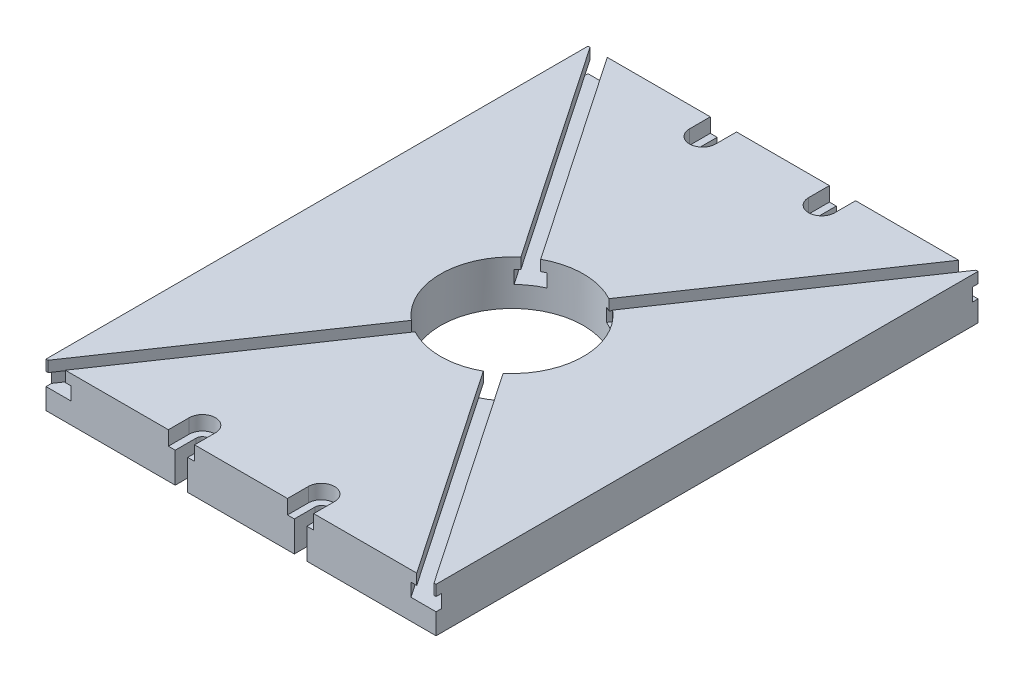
SolidWorks part; units mm, degrees
ref_plane "Plan de face" through (0, 0, 0) normal (0, 0, 1) x (1, 0, 0)
ref_plane "Plan de dessus" through (0, 0, 0) normal (0, 1, 0) x (1, 0, 0)
ref_plane "Plan de droite" through (0, 0, 0) normal (1, 0, 0) x (0, 0, -1)
sketch "Esquisse1" plane through (0, 0, 0) normal (0, 1, 0) x (1, 0, 0)
  line L1 (-327.5, 455) -> (327.5, 455)
  line L2 (-327.5, 455) -> (-327.5, -455)
  line L3 (-327.5, -455) -> (327.5, -455)
  line L4 (327.5, 455) -> (327.5, -455)
  line L5 (-327.5, 455) -> (327.5, -455) construction
  line L6 (-327.5, -455) -> (327.5, 455) construction
  point P0 (0, 0)
  dimension "D1" = 655
  dimension "D2" = 910
extrude "Boss.-Extru.1" add sketch "Esquisse1" along normal blind 75
sketch "Esquisse2" plane through (0, 75, 0) normal (0, 1, 0) x (1, 0, 0)
  line L0 (0, 0) -> (208.2356, 0) construction
  line L1 (0, 0) -> (0, 201.8765) construction
  line L2 (100, -490) -> (100, -420) construction
  line L3 (-327.5, -455) -> (327.5, -455) construction
  line L4 (89.5, -490) -> (89.5, -420)
  line L5 (110.5, -490) -> (110.5, -420)
  line L6 (100, 490) -> (100, 420) construction
  line L7 (89.5, 490) -> (89.5, 420)
  line L8 (110.5, 490) -> (110.5, 420)
  line L9 (-100, 490) -> (-100, 420) construction
  line L10 (-89.5, 490) -> (-89.5, 420)
  line L11 (-110.5, 490) -> (-110.5, 420)
  line L12 (-100, -490) -> (-100, -420) construction
  line L13 (-89.5, -490) -> (-89.5, -420)
  line L14 (-110.5, -490) -> (-110.5, -420)
  arc A0 (89.5, -490) -> (110.5, -490) centre (100, -490) ccw
  arc A1 (110.5, -420) -> (89.5, -420) centre (100, -420) ccw
  arc A2 (89.5, 490) -> (110.5, 490) centre (100, 490) cw
  arc A3 (110.5, 420) -> (89.5, 420) centre (100, 420) cw
  arc A4 (-89.5, 490) -> (-110.5, 490) centre (-100, 490) ccw
  arc A5 (-110.5, 420) -> (-89.5, 420) centre (-100, 420) ccw
  arc A6 (-89.5, -490) -> (-110.5, -490) centre (-100, -490) cw
  arc A7 (-110.5, -420) -> (-89.5, -420) centre (-100, -420) cw
  point P8 (100, -455)
  point P15 (100, 455)
  point P22 (-100, 455)
  point P29 (-100, -455)
  dimension "D2" = 21
  dimension "D3" = 35
  dimension "D1" = 100
extrude "Enlèv. mat.-Extru.1" cut sketch "Esquisse2" against normal up to next
sketch "Esquisse3" plane through (0, 75, 0) normal (0, 1, 0) x (1, 0, 0)
  line L0 (100, -490) -> (100, -420) construction
  line L1 (110.5, -455) -> (327.5, -455) construction
  line L2 (78, -490) -> (78, -420)
  line L3 (122, -490) -> (122, -420)
  line L4 (89.5, -420) -> (89.5, -455) construction
  line L5 (110.5, -455) -> (110.5, -420) construction
  line L6 (0, 0) -> (268.8533, 0) construction
  line L7 (0, 0) -> (0, 257.7302) construction
  line L8 (100, 490) -> (100, 420) construction
  line L9 (78, 490) -> (78, 420)
  line L10 (122, 490) -> (122, 420)
  line L11 (-100, 490) -> (-100, 420) construction
  line L12 (-78, 490) -> (-78, 420)
  line L13 (-122, 490) -> (-122, 420)
  line L14 (-100, -490) -> (-100, -420) construction
  line L15 (-78, -490) -> (-78, -420)
  line L16 (-122, -490) -> (-122, -420)
  arc A0 (78, -490) -> (122, -490) centre (100, -490) ccw
  arc A1 (122, -420) -> (78, -420) centre (100, -420) ccw
  arc A2 (110.5, -420) -> (89.5, -420) centre (100, -420) ccw construction
  arc A3 (78, 490) -> (122, 490) centre (100, 490) cw
  arc A4 (122, 420) -> (78, 420) centre (100, 420) cw
  arc A5 (-78, 490) -> (-122, 490) centre (-100, 490) ccw
  arc A6 (-122, 420) -> (-78, 420) centre (-100, 420) ccw
  arc A7 (-78, -490) -> (-122, -490) centre (-100, -490) cw
  arc A8 (-122, -420) -> (-78, -420) centre (-100, -420) cw
  point P4 (100, -455)
  point P22 (100, 455)
  point P29 (-100, 455)
  point P36 (-100, -455)
  dimension "D1" = 44
extrude "Enlèv. mat.-Extru.2" cut sketch "Esquisse3" against normal blind 24
sketch "Esquisse4" plane through (0, 75, 0) normal (0, 1, 0) x (1, 0, 0)
  line L0 (-324.0265, 455) -> (304.1826, -468.4988)
  line L1 (-324.0265, 455) -> (-304.1826, 468.4988)
  line L2 (304.1826, -468.4988) -> (324.0265, -455)
  line L3 (-304.1826, 468.4988) -> (324.0265, -455)
  line L4 (-324.0265, 455) -> (324.0265, -455) construction
  line L5 (304.1826, -468.4988) -> (-304.1826, 468.4988) construction
  line L6 (0, 0) -> (0, -494.3151) construction
  line L7 (122, -455) -> (327.5, -455) construction
  point P1 (0, 0)
  point P3 (295, -455)
  dimension "D1" = 590
  dimension "D2" = 24
  dimension "D3" = 34.225
extrude "Enlèv. mat.-Extru.3" cut sketch "Esquisse4" against normal blind 18
sketch "Esquisse5" plane through (0, 57, 0) normal (0, 1, 0) x (1, 0, 0)
  line L0 (-300.6288, 477.498) -> (333.702, -455)
  line L1 (-300.6288, 477.498) -> (-333.702, 455)
  line L2 (333.702, -455) -> (300.6288, -477.498)
  line L3 (-333.702, 455) -> (300.6288, -477.498)
  line L4 (-300.6288, 477.498) -> (300.6288, -477.498) construction
  line L5 (333.702, -455) -> (-333.702, 455) construction
  line L6 (-324.0265, 455) -> (295, -455) construction
  line L7 (122, -455) -> (295, -455) construction
  point P1 (0, 0)
  dimension "D1" = 40
extrude "Enlèv. mat.-Extru.4" cut sketch "Esquisse5" against normal offset from surface (22 mm away) 40
mirror "Symétrie1" about plane through (0, 0, 0) normal (1, 0, 0) of "Enlèv. mat.-Extru.3", "Enlèv. mat.-Extru.4"
ref_plane "Rainure droite" through (0, 0, 0) normal (0.8268, 0, -0.5625) x (-0.5625, 0, -0.8268)
ref_plane "Rainure gauche" through (0, 0, 0) normal (0.8268, 0, 0.5625) x (0.5625, 0, -0.8268)
sketch "Esquisse6" plane through (0, 75, 0) normal (0, 1, 0) x (1, 0, 0)
  circle A0 centre (0, 0) radius 120
  dimension "D1" = 240
extrude "Enlèv. mat.-Extru.5" cut sketch "Esquisse6" against normal up to next
